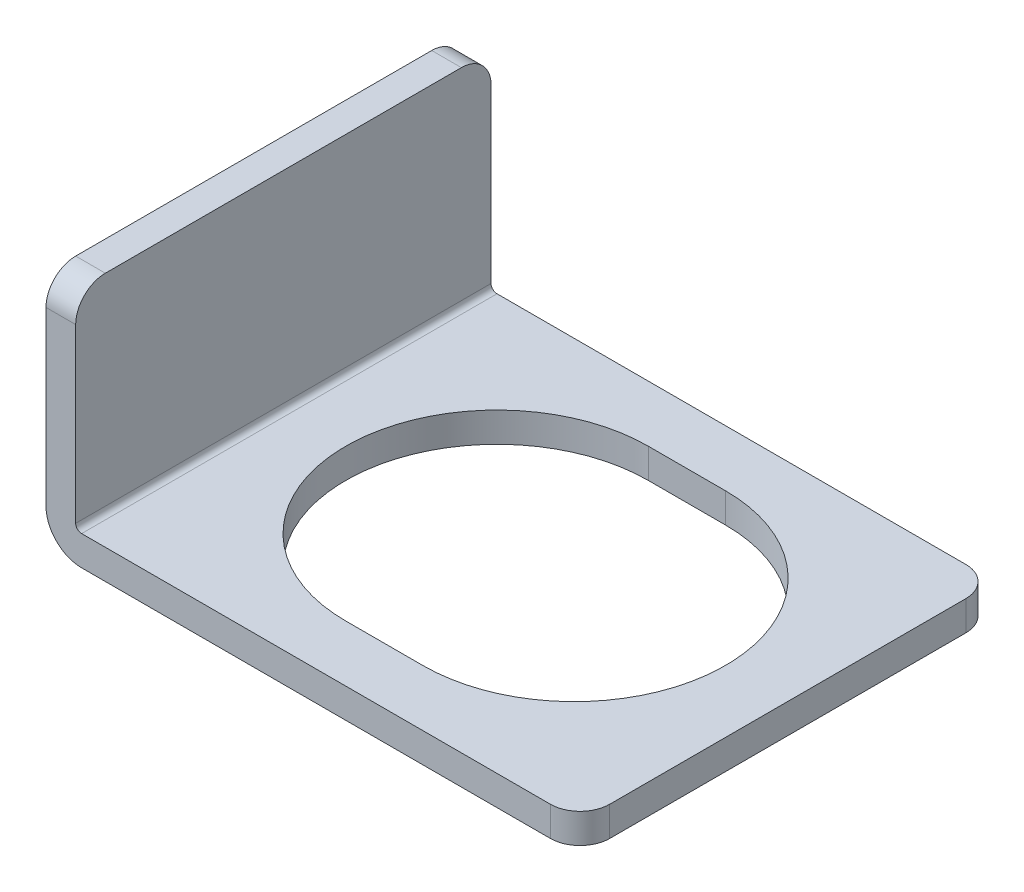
SolidWorks part; units mm, degrees
ref_plane "Front Plane" through (0, 0, 0) normal (0, 0, 1) x (1, 0, 0)
ref_plane "Top Plane" through (0, 0, 0) normal (0, 1, 0) x (1, 0, 0)
ref_plane "Right Plane" through (0, 0, 0) normal (1, 0, 0) x (0, 0, -1)
sketch "Sketch1" plane through (0, 0, 0) normal (0, 0, 1) x (1, 0, 0)
  line L0 (0, 1.2) -> (0, 8)
  line L1 (1.2, 0) -> (18, 0)
  line L2 (1.2, 1) -> (18, 1)
  line L3 (1, 1.2) -> (1, 8)
  line L4 (18, 1) -> (18, 0)
  line L5 (0, 8) -> (1, 8)
  arc A0 (1.2, 0) -> (0, 1.2) centre (1.2, 1.2) cw
  arc A1 (1.2, 1) -> (1, 1.2) centre (1.2, 1.2) cw
  point P6 (0, 0)
  dimension "D3" = 1.2
  dimension "D1" = 8
  dimension "D2" = 18
  dimension "D4" = 1
extrude "Boss-Extrude1" add sketch "Sketch1" along normal mid plane 14
sketch "Sketch2" plane through (0, 1, 0) normal (0, 1, 0) x (1, 0, 0)
  line L0 (8.2, 0) -> (10.8, 0) construction
  line L1 (8.2, 5.1) -> (10.8, 5.1)
  line L2 (8.2, -5.1) -> (10.8, -5.1)
  arc A0 (8.2, 5.1) -> (8.2, -5.1) centre (8.2, 0) ccw
  arc A1 (10.8, -5.1) -> (10.8, 5.1) centre (10.8, 0) ccw
  point P2 (9.5, 0)
  dimension "D1" = 9.5
  dimension "D2" = 10.2
  dimension "D3" = 2.6
extrude "Cut-Extrude1" cut sketch "Sketch2" against normal through all
fillet "Fillet1" radius 1 4 edges at (0.5, 8, -7) (18, 0.5, -7) (18, 0.5, 7) (0.5, 8, 7)
